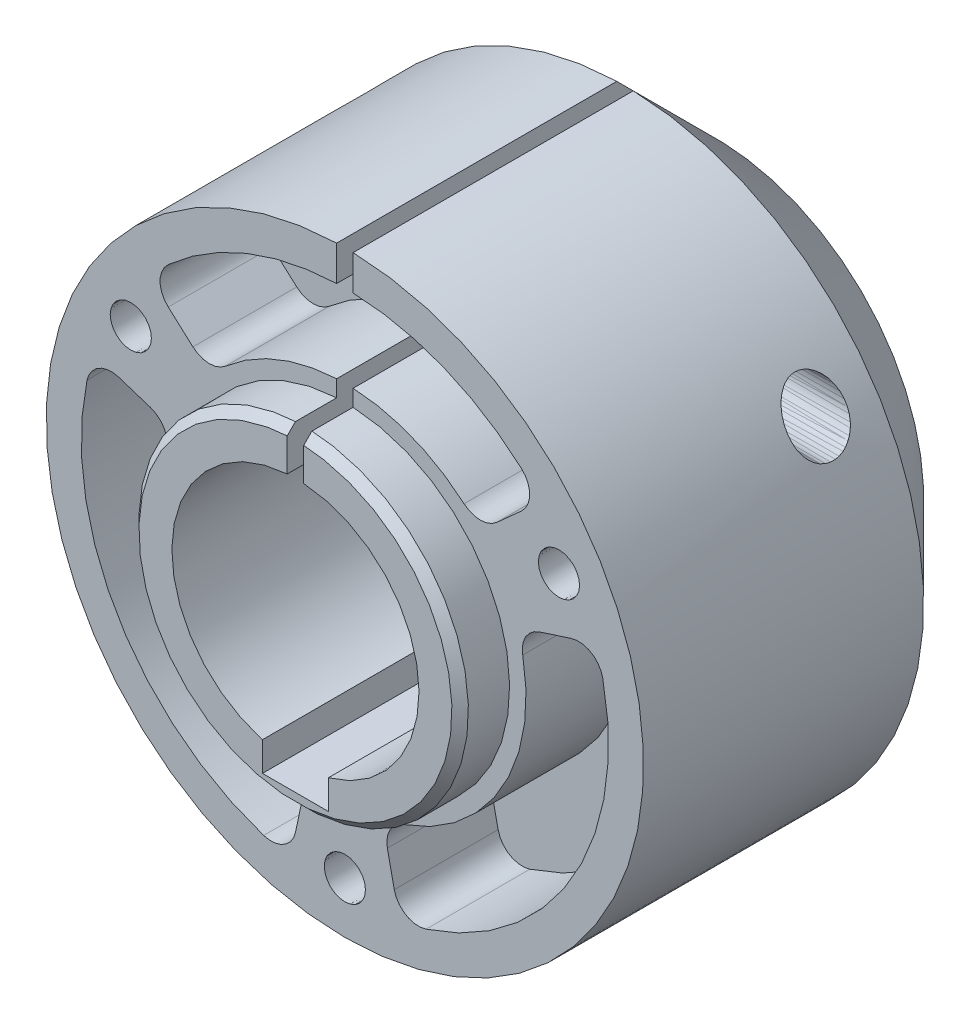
SolidWorks part; units mm, degrees
ref_plane "Plan1" through (0, 0, 0) normal (0, 0, 1) x (1, 0, 0)
ref_plane "Plan2" through (0, 0, 0) normal (0, 1, 0) x (1, 0, 0)
ref_plane "Plan3" through (0, 0, 0) normal (1, 0, 0) x (0, 0, -1)
sketch "Esquisse1" plane through (0, 0, 0) normal (0, 0, 1) x (1, 0, 0)
  line L2 (-1, 36.2362) -> (-1, 14.9666)
  line L3 (-4, -14.4568) -> (-4, -18)
  line L4 (1, 36.2362) -> (1, 14.9666)
  line L5 (-4, -18) -> (4, -18)
  line L6 (4, -14.4568) -> (4, -18)
  arc A0 (-1, 14.9666) -> (-4, -14.4568) centre (0, 0) ccw
  arc A1 (-1, 36.2362) -> (1, 36.2362) centre (0, 0) ccw
  arc A2 (4, -14.4568) -> (1, 14.9666) centre (0, 0) ccw
  dimension "D1" = 30
  dimension "D2" = 72.5
  dimension "D3" = 1
  dimension "D4" = 2
  dimension "D5" = 4
  dimension "D6" = 8
  dimension "D7" = 18
extrude "Base-Extrusion" add sketch "Esquisse1" along normal blind 51
chamfer "Chanfrein1" distance 11 angle 45 1 edges at (0, -36.25, 0)
sketch "Esquisse3"
  circle A0 centre (0, 0) radius 20
  circle A1 centre (0, 0) radius 41.1096
  dimension "D1" = 40
extrude "Enlèv. mat.-Extru.1" cut sketch "Esquisse2" against normal blind 18.6
sketch "Esquisse2" plane through (0, 0, 51) normal (0, 0, 1) x (1, 0, 0)
  line L0 (-25.9808, 15) -> (0, 0) construction
  line L1 (0, 0) -> (0, -35) construction
  line L2 (0, 0) -> (28.1458, 16.25) construction
  line L3 (-18.4444, 16.6074) -> (-21.4356, 19.3007)
  line L4 (-23.6046, 7.6696) -> (-27.4327, 8.9134)
  line L9 (21.4356, 19.3007) -> (18.4444, 16.6074)
  line L10 (27.4327, 8.9134) -> (23.6046, 7.6696)
  line L11 (-5.1602, -24.277) -> (-5.9971, -28.2141)
  line L12 (5.1602, -24.277) -> (5.9971, -28.2141)
  circle A0 centre (-25.9808, 15) radius 2.5
  circle A1 centre (25.9808, 15) radius 2.5
  circle A2 centre (0, -30) radius 2.5
  arc A3 (21.438, 23.7574) -> (-21.438, 23.7574) centre (0, 0) ccw
  arc A4 (-21.5879, 4.2385) -> (-7.1233, -20.8149) centre (0, 0) ccw
  arc A5 (-31.2935, 6.6872) -> (-9.8555, -30.4445) centre (0, 0) ccw
  arc A6 (14.4645, 16.5764) -> (-14.4645, 16.5764) centre (0, 0) ccw
  arc A7 (7.1233, -20.8149) -> (21.5879, 4.2385) centre (0, 0) ccw
  arc A8 (-21.4356, 19.3007) -> (-21.438, 23.7574) centre (-19.4282, 21.5301) cw
  arc A9 (9.8555, -30.4445) -> (31.2935, 6.6872) centre (0, 0) ccw
  arc A10 (-18.4444, 16.6074) -> (-14.4645, 16.5764) centre (-16.437, 18.8368) ccw
  arc A11 (21.4356, 19.3007) -> (21.438, 23.7574) centre (19.4282, 21.5301) ccw
  arc A12 (18.4444, 16.6074) -> (14.4645, 16.5764) centre (16.437, 18.8368) cw
  arc A13 (21.5879, 4.2385) -> (23.6046, 7.6696) centre (24.5317, 4.8164) cw
  arc A14 (27.4327, 8.9134) -> (31.2935, 6.6872) centre (28.3597, 6.0602) cw
  arc A15 (5.1602, -24.277) -> (7.1233, -20.8149) centre (8.0947, -23.6532) cw
  arc A16 (9.8555, -30.4445) -> (5.9971, -28.2141) centre (8.9315, -27.5904) cw
  arc A17 (-9.8555, -30.4445) -> (-5.9971, -28.2141) centre (-8.9315, -27.5904) ccw
  arc A18 (-5.1602, -24.277) -> (-7.1233, -20.8149) centre (-8.0947, -23.6532) ccw
  arc A19 (-31.2935, 6.6872) -> (-27.4327, 8.9134) centre (-28.3597, 6.0602) cw
  arc A20 (-21.5879, 4.2385) -> (-23.6046, 7.6696) centre (-24.5317, 4.8164) ccw
  dimension "D1" = 5
  dimension "D2" = 44
  dimension "D5" = 3
  dimension "D12" = 3
  dimension "D3" = 120
  dimension "D4" = 120
  dimension "D6" = 12
  dimension "D7" = 24
extrude "Enlèv. mat.-Extru.2" cut sketch "Esquisse3" against normal blind 6
chamfer "Chanfrein4" distance 1 angle 45 1 edges at (0, -20, 51)
ref_plane "Plan4" through (0, 0, 18) normal (0, 0, 1) x (1, 0, 0)
sketch "Esquisse4" plane through (0, 0, 18) normal (0, 0, 1) x (1, 0, 0)
  line L0 (-32, 20) -> (35, 20) construction
  line L1 (-17, 23.5) -> (33, 23.5)
  line L2 (33, 23.5) -> (33, 20)
  line L3 (33, 20) -> (-38, 20)
  line L4 (-38, 20) -> (-38, 26.5)
  line L5 (-38, 26.5) -> (-17, 26.5)
  line L6 (-17, 26.5) -> (-17, 23.5)
  dimension "D1" = 3.5
  dimension "D2" = 6.5
  dimension "D3" = 17
  dimension "D4" = 20
revolve "Enlèvement de matière-Révolution1" cut sketch "Esquisse4" angle 360 about L0
